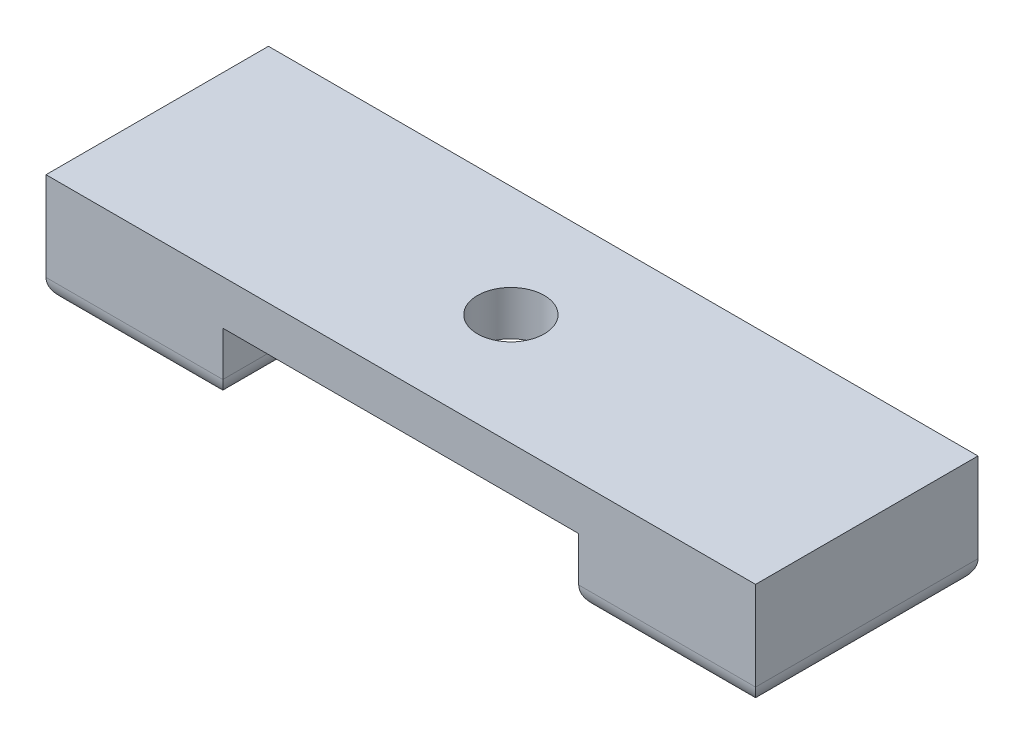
SolidWorks part; units mm, degrees
ref_plane "Plan de face" through (0, 0, 0) normal (0, 0, 1) x (1, 0, 0)
ref_plane "Plan de dessus" through (0, 0, 0) normal (0, 1, 0) x (1, 0, 0)
ref_plane "Plan de droite" through (0, 0, 0) normal (1, 0, 0) x (0, 0, -1)
sketch "Esquisse1" plane through (0, 0, 0) normal (0, 0, 1) x (1, 0, 0)
  line L0 (0, 0) -> (7.95, 0)
  line L1 (7.95, 0) -> (7.95, 3)
  line L2 (7.95, 3) -> (23.95, 3)
  line L3 (23.95, 3) -> (23.95, 0)
  line L4 (23.95, 0) -> (31.9, 0)
  line L5 (31.9, 0) -> (31.9, 5)
  line L6 (31.9, 5) -> (0, 5)
  line L7 (0, 5) -> (0, 0)
  dimension "D1" = 7.95
  dimension "D2" = 7.95
  dimension "D3" = 16
  dimension "D4" = 5
  dimension "D5" = 3
extrude "Boss.-Extru.1" add sketch "Esquisse1" along normal blind 10
sketch "Esquisse2" plane through (0, 5, 0) normal (0, 1, 0) x (1, 0, 0)
  line L0 (31.9, -10) -> (31.9, 0) construction
  line L1 (31.9, 0) -> (0, 0) construction
  circle A0 centre (15.9, -5) radius 1.5
  dimension "D1" = 3
  dimension "D2" = 16
  dimension "D3" = 5
extrude "Enlèv. mat.-Extru.1" cut sketch "Esquisse2" against normal blind 10
fillet "Congé1" radius 1 4 edges at (23.95, 0, 5) (27.925, 0, 10) (31.9, 0, 5) (27.925, 0, 0)
fillet "Congé2" radius 1 4 edges at (3.975, 0, 0) (0, 0, 5) (3.975, 0, 10) (7.95, 0, 5)
